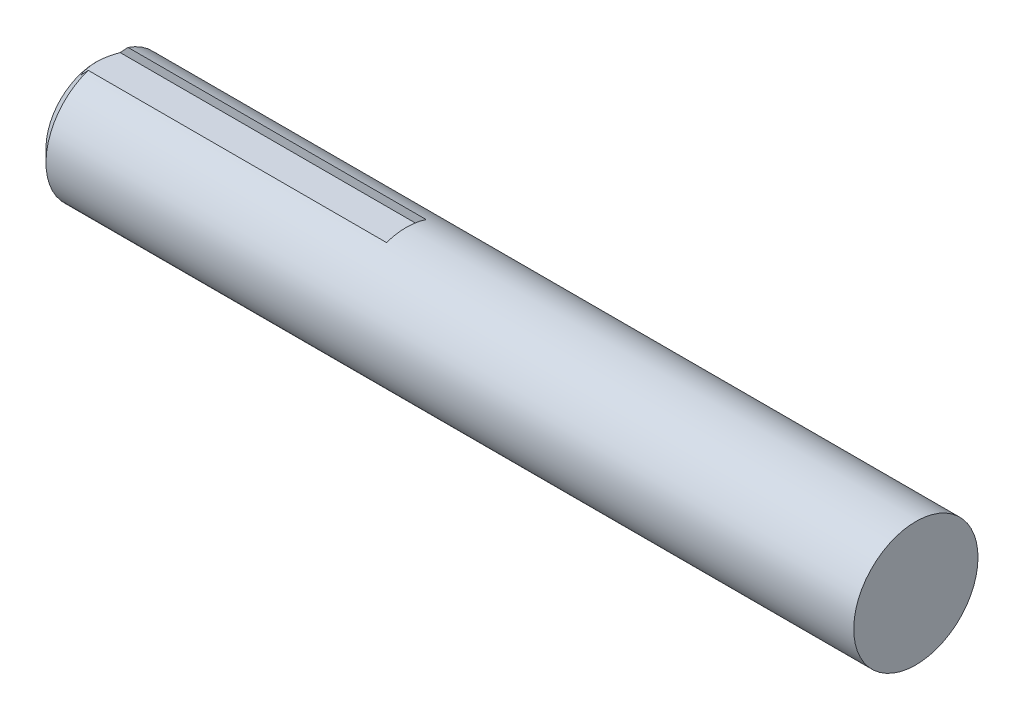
SolidWorks part; units mm, degrees
ref_plane "Front" through (0, 0, 0) normal (0, 0, 1) x (1, 0, 0)
ref_plane "Top" through (0, 0, 0) normal (0, 1, 0) x (1, 0, 0)
ref_plane "Right" through (0, 0, 0) normal (1, 0, 0) x (0, 0, -1)
sketch "Sketch2" plane through (0, 0, 0) normal (1, 0, 0) x (0, 0, -1)
  circle A0 centre (0, 0) radius 25
  dimension "D1" = 50
extrude "Boss-Extrude1" add sketch "Sketch2" along normal blind 330
sketch "Sketch3" plane through (0, 0, 0) normal (-1, 0, 0) x (0, 0, 1)
  line L1 (-8, 29.3) -> (8, 29.3)
  line L2 (-8, 29.3) -> (-8, 20.3)
  line L3 (-8, 20.3) -> (8, 20.3)
  line L4 (8, 29.3) -> (8, 20.3)
  line L5 (-8, 29.3) -> (8, 20.3) construction
  line L6 (-8, 20.3) -> (8, 29.3) construction
  circle A1 centre (0, 0) radius 25 construction
  point P0 (0, 24.8)
  dimension "D1" = 16
  dimension "D2" = 4.7
  dimension "D3" = 9
chamfer "Chamfer1" distance 5 angle 45 1 edges at (0, 0, -25)
extrude "Cut-Extrude1" cut sketch "Sketch3" against normal blind 125 contours L4 L3 L2 L1
